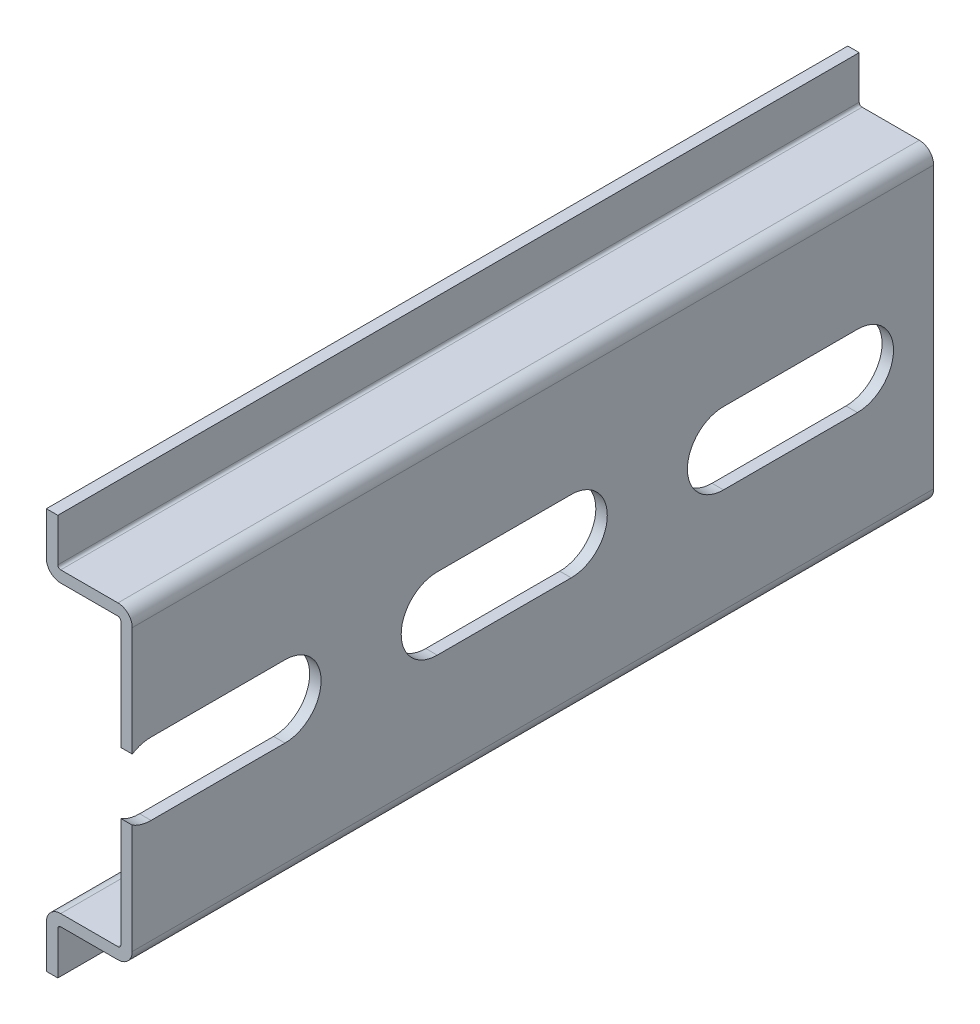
SolidWorks part; units mm, degrees
ref_plane "Front Plane" through (0, 0, 0) normal (0, 0, 1) x (1, 0, 0)
ref_plane "Top Plane" through (0, 0, 0) normal (0, 1, 0) x (1, 0, 0)
ref_plane "Right Plane" through (0, 0, 0) normal (1, 0, 0) x (0, 0, -1)
sketch "Sketch1" plane through (0, 0, 0) normal (0, 0, 1) x (1, 0, 0)
  line L0 (0, -13.5) -> (0, 13.5) construction
  line L1 (0, 13.5) -> (-6.5, 13.5) construction
  line L2 (-6.5, 13.5) -> (-6.5, 17.5) construction
  line L3 (0, -13.5) -> (-6.5, -13.5) construction
  line L4 (-6.5, -13.5) -> (-6.5, -17.5) construction
  line L5 (-7.5, 0) -> (0, 0) construction
  line L6 (-6.5, 17.5) -> (-7.5, 17.5) construction
  line L7 (-7.5, 0) -> (-7.5, 17.5) construction
sketch "Sketch2" plane through (0, 0, 0) normal (1, 0, 0) x (0, 0, -1)
  line L0 (50.0062, 0) -> (-50.0063, 0) construction
  line L1 (37.5047, 17.5) -> (37.5047, -17.5) construction
  line L2 (-37.5047, 17.5) -> (-37.5047, -17.5) construction
  line L3 (37.5047, 17.5) -> (-37.5047, 17.5) construction
  line L4 (0, 0) -> (0, 17.5) construction
  line L5 (-12.5, 0) -> (12.5, 0) construction
  line L6 (18.35, 0) -> (6.65, 0) construction
  line L7 (18.35, -3.15) -> (6.65, -3.15)
  line L8 (18.35, 3.15) -> (6.65, 3.15)
  line L9 (-50.0063, -3.15) -> (-50.0062, 3.15)
  line L10 (50.0062, -3.15) -> (50.0062, 3.15)
  arc A0 (18.35, -3.15) -> (18.35, 3.15) centre (18.35, 0) ccw
  arc A1 (6.65, 3.15) -> (6.65, -3.15) centre (6.65, 0) ccw
  point P8 (-37.5047, 0)
  point P9 (37.5047, 0)
  point P14 (0, 0)
  point P17 (12.5, 0)
  point P25 (50.0062, 0)
  point P28 (-50.0063, 0)
sketch "Sketch3" plane through (0, 0, 0) normal (0, 0, 1) x (1, 0, 0)
  line L0 (-6.5, -13.5) -> (-6.5, -17.5) construction
  line L1 (0, -13.5) -> (-6.5, -13.5) construction
  line L2 (0, -13.5) -> (0, 13.5) construction
  line L3 (0, 13.5) -> (-6.5, 13.5) construction
  line L4 (-6.5, 13.5) -> (-6.5, 17.5) construction
  line L5 (-6.5, -13.5) -> (-6.5, -17.5)
  line L6 (0, -13.5) -> (-6.5, -13.5)
  line L7 (0, -13.5) -> (0, 13.5)
  line L8 (0, 13.5) -> (-6.5, 13.5)
  line L9 (-6.5, 13.5) -> (-6.5, 17.5)
extrude "Extrude-Thin1" add sketch "Sketch3" along normal up to vertex (50.0063 mm away) and the other way up to vertex (50.0063 mm away) thin
sketch "Sketch4" plane through (0, 0, 0) normal (1, 0, 0) x (0, 0, -1)
  line L0 (6.65, 0) -> (18.35, 0) construction
  line L1 (6.65, 3.15) -> (18.35, 3.15)
  line L4 (6.65, -3.15) -> (18.35, -3.15)
  line L5 (18.35, 3.15) -> (6.65, 3.15) construction
  line L6 (31.65, -3.15) -> (43.35, -3.15)
  line L7 (31.65, 3.15) -> (43.35, 3.15)
  line L8 (31.65, 0) -> (43.35, 0) construction
  line L9 (56.65, -3.15) -> (68.35, -3.15)
  line L10 (56.65, 3.15) -> (68.35, 3.15)
  line L11 (56.65, 0) -> (68.35, 0) construction
  line L18 (50.0062, 0) -> (-50.0063, 0) construction
  line L19 (-18.35, -3.15) -> (-6.65, -3.15)
  line L20 (-18.35, 3.15) -> (-6.65, 3.15)
  line L21 (-18.35, 0) -> (-6.65, 0) construction
  line L22 (-43.35, -3.15) -> (-31.65, -3.15)
  line L23 (-43.35, 3.15) -> (-31.65, 3.15)
  line L24 (-43.35, 0) -> (-31.65, 0) construction
  line L25 (-68.35, -3.15) -> (-56.65, -3.15)
  line L26 (-68.35, 3.15) -> (-56.65, 3.15)
  line L27 (-68.35, 0) -> (-56.65, 0) construction
  arc A2 (6.65, 3.15) -> (6.65, -3.15) centre (6.65, 0) ccw
  arc A3 (18.35, -3.15) -> (18.35, 3.15) centre (18.35, 0) ccw
  arc A4 (31.65, 3.15) -> (31.65, -3.15) centre (31.65, 0) ccw
  arc A5 (43.35, -3.15) -> (43.35, 3.15) centre (43.35, 0) ccw
  arc A6 (56.65, 3.15) -> (56.65, -3.15) centre (56.65, 0) ccw
  arc A7 (68.35, -3.15) -> (68.35, 3.15) centre (68.35, 0) ccw
  arc A12 (-18.35, 3.15) -> (-18.35, -3.15) centre (-18.35, 0) ccw
  arc A13 (-6.65, -3.15) -> (-6.65, 3.15) centre (-6.65, 0) ccw
  arc A14 (-43.35, 3.15) -> (-43.35, -3.15) centre (-43.35, 0) ccw
  arc A15 (-31.65, -3.15) -> (-31.65, 3.15) centre (-31.65, 0) ccw
  arc A16 (-68.35, 3.15) -> (-68.35, -3.15) centre (-68.35, 0) ccw
  arc A17 (-56.65, -3.15) -> (-56.65, 3.15) centre (-56.65, 0) ccw
  point P3 (12.5, 0)
  point P15 (37.5, 0)
  point P22 (62.5, 0)
  point P45 (-12.5, 0)
  point P52 (-37.5, 0)
  point P59 (-62.5, 0)
extrude "Cut-Extrude1" cut sketch "Sketch4" against normal through all both and the other way through all
fillet "Fillet1" radius 0.25 4 edges at (-6.5, 13.5, 0) (-6.5, -13.5, 0) (-1, 12.5, 0) (-1, -12.5, 0)
fillet "Fillet2" radius 1.25 4 edges at (-7.5, -12.5, 0) (0, -13.5, 0) (0, 13.5, 0) (-7.5, 12.5, 0)
sketch "Sketch6" plane through (0, 0, 0) normal (1, 0, 0) x (0, 0, -1)
  line L0 (-50.0063, -17.5) -> (50.0062, -17.5) construction
  line L1 (-50.0063, 17.5) -> (-19.9938, 17.5)
  line L2 (-50.0063, 17.5) -> (-50.0063, -17.5)
  line L3 (-50.0063, -17.5) -> (-19.9938, -17.5)
  line L4 (-19.9938, 17.5) -> (-19.9938, -17.5)
  line L5 (50.0062, -12.25) -> (50.0062, 12.25) construction
  dimension "D1" = 70
extrude "Cut-Extrude2" cut sketch "Sketch6" against normal through all both and the other way through all
equation "\"D5@Extrude-Thin1\"=\"Metal Thickness@Sketch1\""
equation "\"D1@Sketch2\"=\"Length@Sketch2\"*.75"
equation "\"D2@Sketch4\"=\"Mounting Hole Center-to-Center@Sketch2\""
equation "\"D4@Sketch4\"=\"D2@Sketch4\""
equation "\"D3@Sketch2\"=\"Mounting Hole Diameter@Sketch2\""
